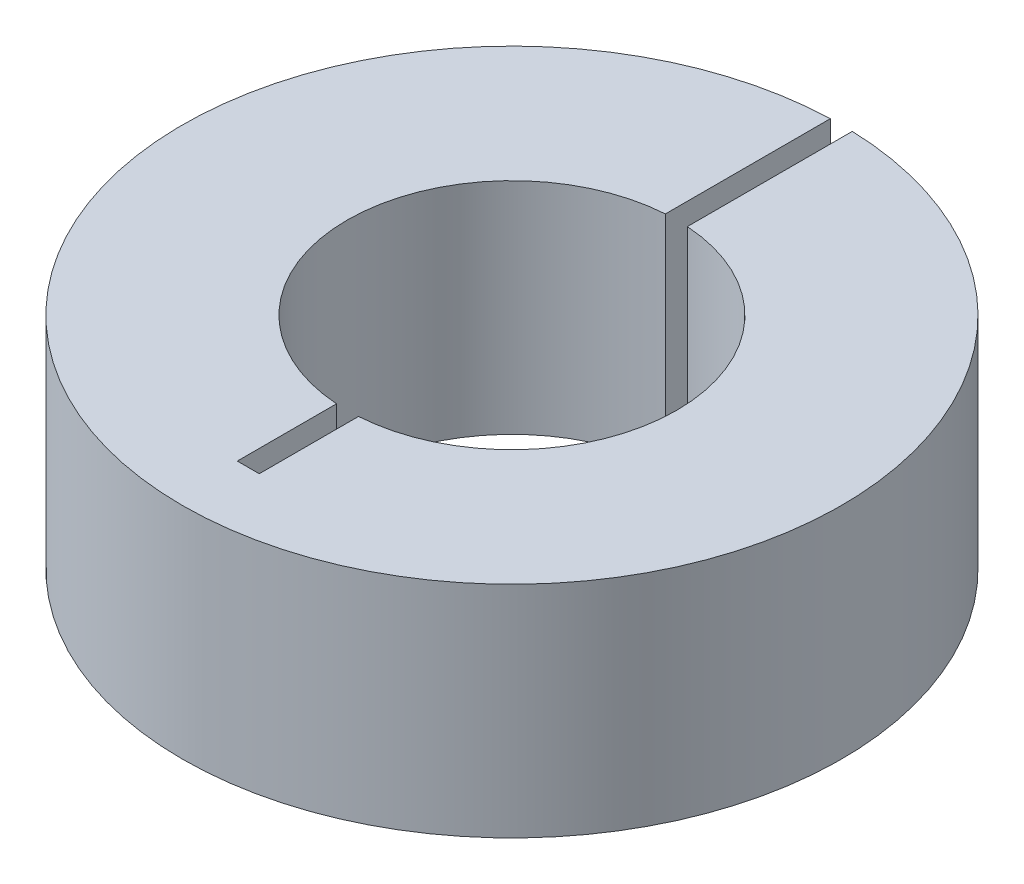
SolidWorks part; units mm, degrees
ref_plane "Front Plane" through (0, 0, 0) normal (0, 0, 1) x (1, 0, 0)
ref_plane "Top Plane" through (0, 0, 0) normal (0, 1, 0) x (1, 0, 0)
ref_plane "Right Plane" through (0, 0, 0) normal (1, 0, 0) x (0, 0, -1)
sketch "Sketch1" plane through (0, 0, 0) normal (0, 1, 0) x (1, 0, 0)
  circle A0 centre (0, 0) radius 9.525
  circle A1 centre (0, 0) radius 19.05
  dimension "D1" = 19.05
  dimension "D2" = 38.1
extrude "Extrude1" add sketch "Sketch1" along normal blind 12.7
sketch "Sketch2" plane through (0, 12.7, 0) normal (0, 1, 0) x (-1, 0, 0)
  line L1 (0.635, -35.56) -> (-0.635, -35.56)
  line L2 (0.635, -35.56) -> (0.635, 15.24)
  line L3 (0.635, 15.24) -> (-0.635, 15.24)
  line L4 (-0.635, -35.56) -> (-0.635, 15.24)
  circle A0 centre (0, 0) radius 9.525 construction
  dimension "D1" = 50.8
  dimension "D2" = 1.27
  dimension "D3" = 0.635
  dimension "D4" = 15.24
extrude "Cut-Extrude1" cut sketch "Sketch2" against normal through all
equation "\"D3@Sketch2\" = \"D2@Sketch2\"/2"
